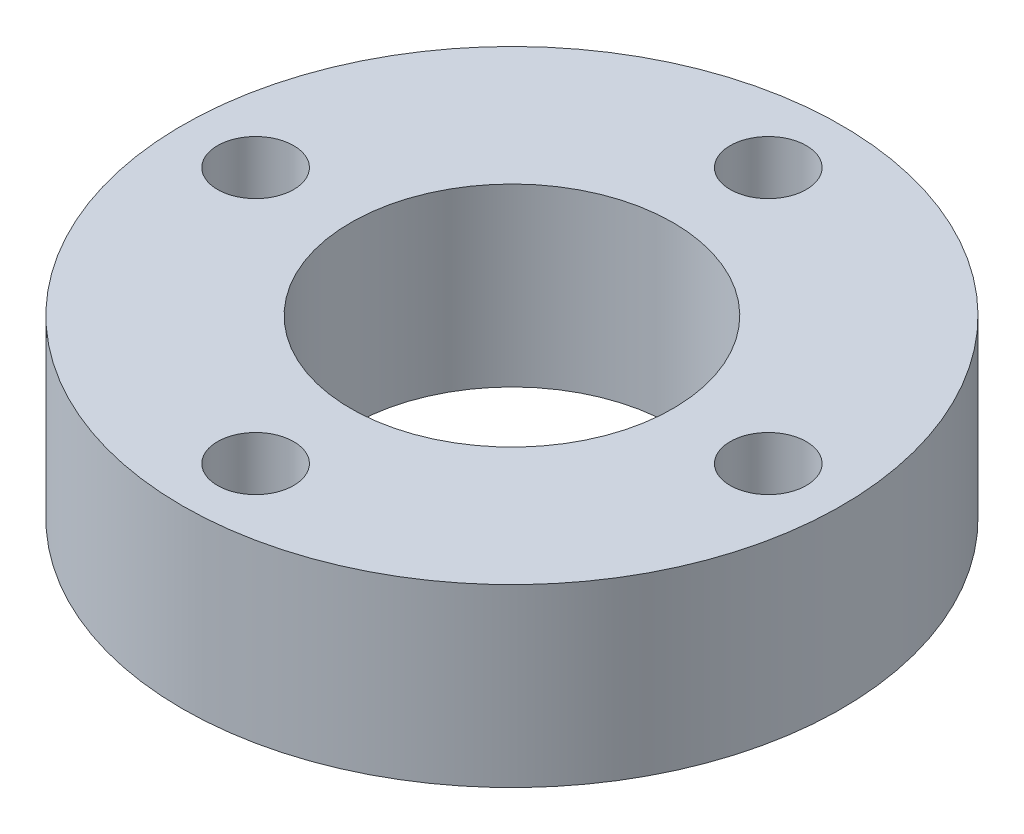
SolidWorks part; units mm, degrees
ref_plane "前视基准面" through (0, 0, 0) normal (0, 0, 1) x (1, 0, 0)
ref_plane "上视基准面" through (0, 0, 0) normal (0, 1, 0) x (1, 0, 0)
ref_plane "右视基准面" through (0, 0, 0) normal (1, 0, 0) x (0, 0, -1)
other "Configuration Table"
sketch "草图1" plane through (0, 0, 0) normal (0, 1, 0) x (1, 0, 0)
  circle A0 centre (0, 0) radius 22.5
  dimension "D1" = 45
extrude "凸台-拉伸1" add sketch "草图1" along normal blind 12
sketch "草图2" plane through (0, 0, 0) normal (0, -1, 0) x (1, 0, 0)
  circle A0 centre (0, 0) radius 17.5
  circle A1 centre (17.5, 0) radius 4.2
  circle A2 centre (0, 17.5) radius 4.2
  circle A3 centre (-17.5, 0) radius 4.2
  circle A4 centre (0, -17.5) radius 4.2
  dimension "D1" = 35
  dimension "D2" = 8.4
  dimension "D3" = 8.4
  dimension "D4" = 8.4
  dimension "D5" = 8.4
extrude "切除-拉伸1" cut sketch "草图2" against normal blind 4.4 contours A0 A1 | A0 A1 | A0 A4 | A0 A4 | A0 A3 | A0 A2 | A0 A2
sketch "草图3" plane through (0, 0, 0) normal (0, -1, 0) x (1, 0, 0)
  circle A0 centre (0, 17.5) radius 2.6
  circle A1 centre (17.5, 0) radius 2.6
  circle A2 centre (0, -17.5) radius 2.6
  circle A3 centre (-17.5, 0) radius 2.6
  dimension "D1" = 5.2
  dimension "D2" = 5.2
  dimension "D3" = 5.2
  dimension "D4" = 5.2
extrude "切除-拉伸2" cut sketch "草图3" against normal through all
sketch "草图4" plane through (0, 0, 0) normal (0, -1, 0) x (1, 0, 0)
  circle A0 centre (0, 0) radius 4
  dimension "D1" = 8
extrude "切除-拉伸3" cut sketch "草图4" against normal through all
sketch "草图5" plane through (0, 0, 0) normal (0, -1, 0) x (1, 0, 0)
  circle A0 centre (0, 0) radius 11
  dimension "D1" = 22
extrude "切除-拉伸4" cut sketch "草图5" against normal through all
